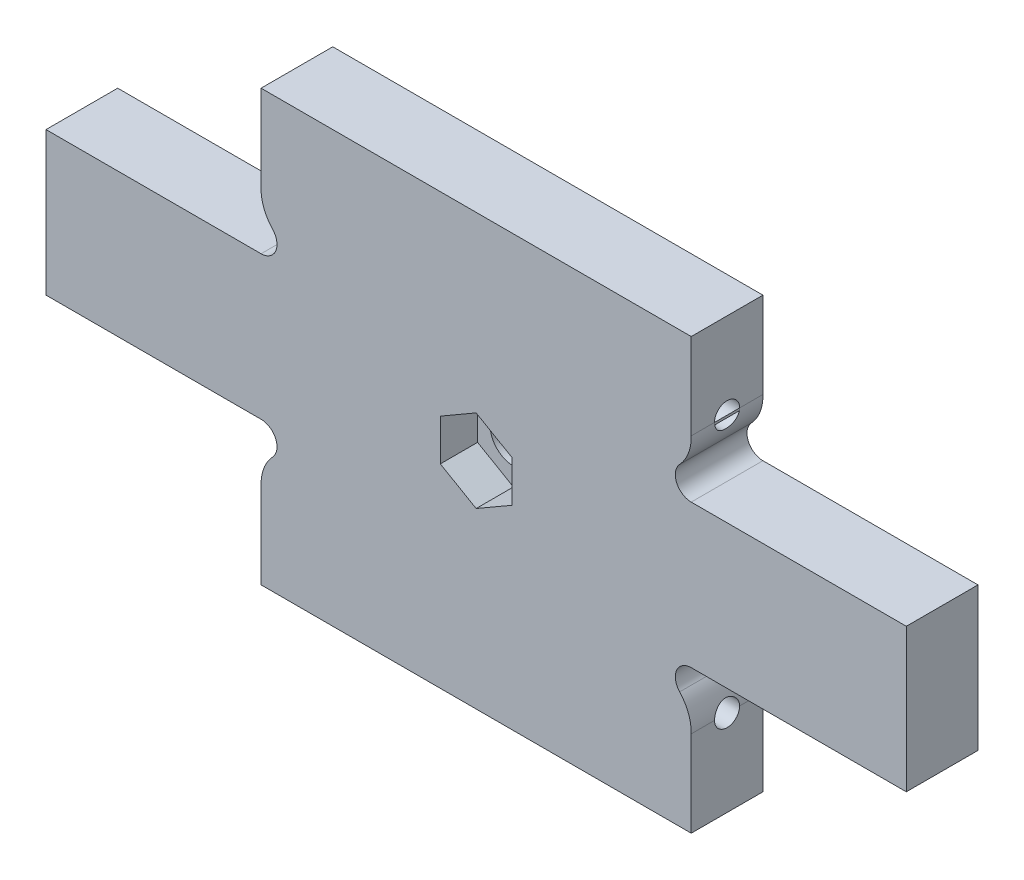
SolidWorks part; units mm, degrees
ref_plane "Plan de face" through (0, 0, 0) normal (0, 0, 1) x (1, 0, 0)
ref_plane "Plan de dessus" through (0, 0, 0) normal (0, 1, 0) x (1, 0, 0)
ref_plane "Plan de droite" through (0, 0, 0) normal (1, 0, 0) x (0, 0, -1)
sketch "Esquisse1" plane through (0, 0, 0) normal (0, 0, 1) x (1, 0, 0)
  line L6 (30, -10) -> (60, -10)
  line L7 (60, -10) -> (60, 10)
  line L8 (60, 10) -> (30, 10)
  line L10 (30, 30) -> (-30, 30)
  line L11 (-30, 30) -> (-30, 18)
  line L12 (-30, 10) -> (-60, 10)
  line L13 (-60, 10) -> (-60, -10)
  line L14 (-60, -10) -> (-30, -10)
  line L15 (-29.9978, -18) -> (-29.9978, -30)
  line L16 (-29.9978, -30) -> (30, -30)
  line L17 (30, -30) -> (29.9978, -18)
  line L18 (0, -55) -> (0, 55) construction
  line L19 (30, 30) -> (30, 18)
  arc A0 (29.9978, -18) -> (28.3796, -13.7374) centre (24, -17.8386) ccw
  arc A1 (30, -10) -> (28.3796, -13.7374) centre (30, -12.22) ccw
  arc A4 (-30, 18) -> (-28.3796, 13.7374) centre (-24.0021, 17.8408) ccw
  arc A5 (-30, 10) -> (-28.3796, 13.7374) centre (-30, 12.22) ccw
  arc A6 (-28.3796, -13.7374) -> (-30, -10) centre (-30, -12.22) ccw
  arc A7 (-28.3796, -13.7374) -> (-29.9978, -18) centre (-24, -17.8386) ccw
  arc A8 (30, 10) -> (28.3796, 13.7374) centre (30, 12.22) cw
  arc A9 (30, 18) -> (28.3796, 13.7374) centre (24.0021, 17.8408) cw
  dimension "D1" = 60
  dimension "D2" = 20
  dimension "D3" = 20
  dimension "D4" = 30
  dimension "D5" = 12
  dimension "D6" = 30
  dimension "D7" = 10
  dimension "D8" = 10
  dimension "D9" = 12
  dimension "D10" = 12
  dimension "D11" = 30
  dimension "D12" = 30
extrude "Boss.-Extru.1" add sketch "Esquisse1" along normal blind 10
sketch "Esquisse2" plane through (0, 0, 10) normal (0, 0, 1) x (1, 0, 0)
  circle A0 centre (0, 0) radius 3.25
  dimension "D1" = 6.5
extrude "Enlèv. mat.-Extru.1" cut sketch "Esquisse2" against normal blind 10
sketch "Esquisse3" plane through (0, 0, 10) normal (0, 0, 1) x (1, 0, 0)
  line L1 (5, -2.8868) -> (5, 2.8868)
  line L2 (5, 2.8868) -> (0, 5.7735)
  line L3 (0, 5.7735) -> (-5, 2.8868)
  line L4 (-5, 2.8868) -> (-5, -2.8868)
  line L5 (-5, -2.8868) -> (0, -5.7735)
  line L6 (0, -5.7735) -> (5, -2.8868)
  circle A0 centre (0, 0) radius 5 construction
  dimension "D1" = 10
extrude "Enlèv. mat.-Extru.2" cut sketch "Esquisse3" against normal blind 5.2
hole_wizard "Diamètre du perçage Ø3.5 (3.5)1" positions "Esquisse4" profile "Esquisse5" hole size "Ø3.5" standard "ISO"
sketch "Esquisse4" plane through (30, 0, 0) normal (1, 0, 0) x (0, 0, -1)
  line L0 (55, 0) -> (-55, 0) construction
  line L1 (0, -30) -> (0, -18) construction
  point P0 (-5, 18)
  point P2 (-5, -18)
  dimension "D1" = 18
  dimension "D2" = 18
  dimension "D3" = 5
  dimension "D4" = 5
sketch "Esquisse5" plane through (30, 18, 5) normal (0, 1, 0) x (0, 0, -1)
  line L0 (0, 0) -> (0, 15.0515)
  line L1 (0, 15.0515) -> (1.75, 14)
  line L2 (1.75, 14) -> (1.75, 0)
  line L5 (1.75, 0) -> (0, 0)
  line L10 (0, 15.0515) -> (-1.75, 14) construction
  line L11 (0, -6.35) -> (0, 107.95) construction
  dimension "Diamètre du perçage" = 3.5
  dimension "Profondeur du perçage" = 14
  dimension "Angle de pointe" = 118
mirror "Symétrie1" about plane through (0, 0, 0) normal (1, 0, 0) of "Diamètre du perçage Ø3.5 (3.5)1"
